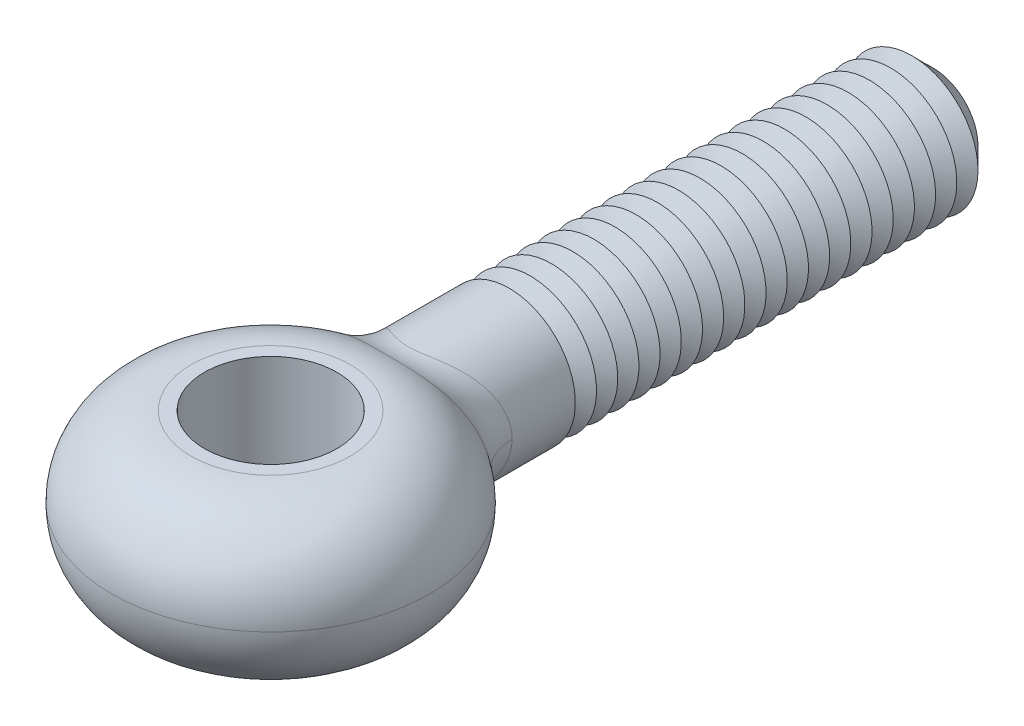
SolidWorks part; units mm, degrees
ref_plane "Front Plane" through (0, 0, 0) normal (0, 0, 1) x (1, 0, 0)
ref_plane "Top Plane" through (0, 0, 0) normal (0, 1, 0) x (1, 0, 0)
ref_plane "Right Plane" through (0, 0, 0) normal (1, 0, 0) x (0, 0, -1)
sketch "Sketch7" plane through (0, 0, 0) normal (0, 1, 0) x (1, 0, 0)
  circle A0 centre (0, 0) radius 6
  dimension "D1" = 12
extrude "Boss-Extrude3" add sketch "Sketch7" along normal mid plane 6
sketch "Sketch8" plane through (0, 0, 0) normal (0, 0, 1) x (1, 0, 0)
  circle A0 centre (0, 0) radius 2.5
  dimension "D1" = 5
extrude "Boss-Extrude4" add sketch "Sketch8" against normal blind 25
fillet "Fillet5" radius 3 2 edges at (0, -3, 6) (0, 3, 6)
fillet "Fillet6" radius 2 2 edges at (0.0752, -2.4989, -4.6594) (-0.0752, 2.4989, -4.6594)
chamfer "Chamfer1" distance 0.8 angle 45 1 edges at (2.5, 0, -25)
sketch "Sketch10" plane through (0, 0, 0) normal (0, 1, 0) x (1, 0, 0)
  line L0 (0, 28.1405) -> (0, -7.9233) construction
sketch "Sketch11" plane through (0, 0, 0) normal (0, 1, 0) x (1, 0, 0)
  line L0 (-2.5, 9) -> (-1.8072, 9.4)
  line L1 (-2.5, 24.2) -> (-2.5, 6.6144) construction
  line L2 (-1.8072, 9.4) -> (-2.5, 9.8)
  line L3 (-2.5, 9.8) -> (-2.5, 9)
  line L4 (1.7, 25) -> (-1.7, 25) construction
  dimension "D1" = 0.8
  dimension "D2" = 16
revolve "Cut-Revolve1" cut sketch "Sketch11" angle 360 about L0
pattern_linear "LPattern1" count 19 spacing 0.8 along (0, 0, -1) of "Cut-Revolve1"
sketch "Sketch12" plane through (0, 0, 0) normal (0, 1, 0) x (1, 0, 0)
  circle A0 centre (0, 0) radius 2.5
  dimension "D1" = 5
extrude "Cut-Extrude1" cut sketch "Sketch12" against normal mid plane 6
